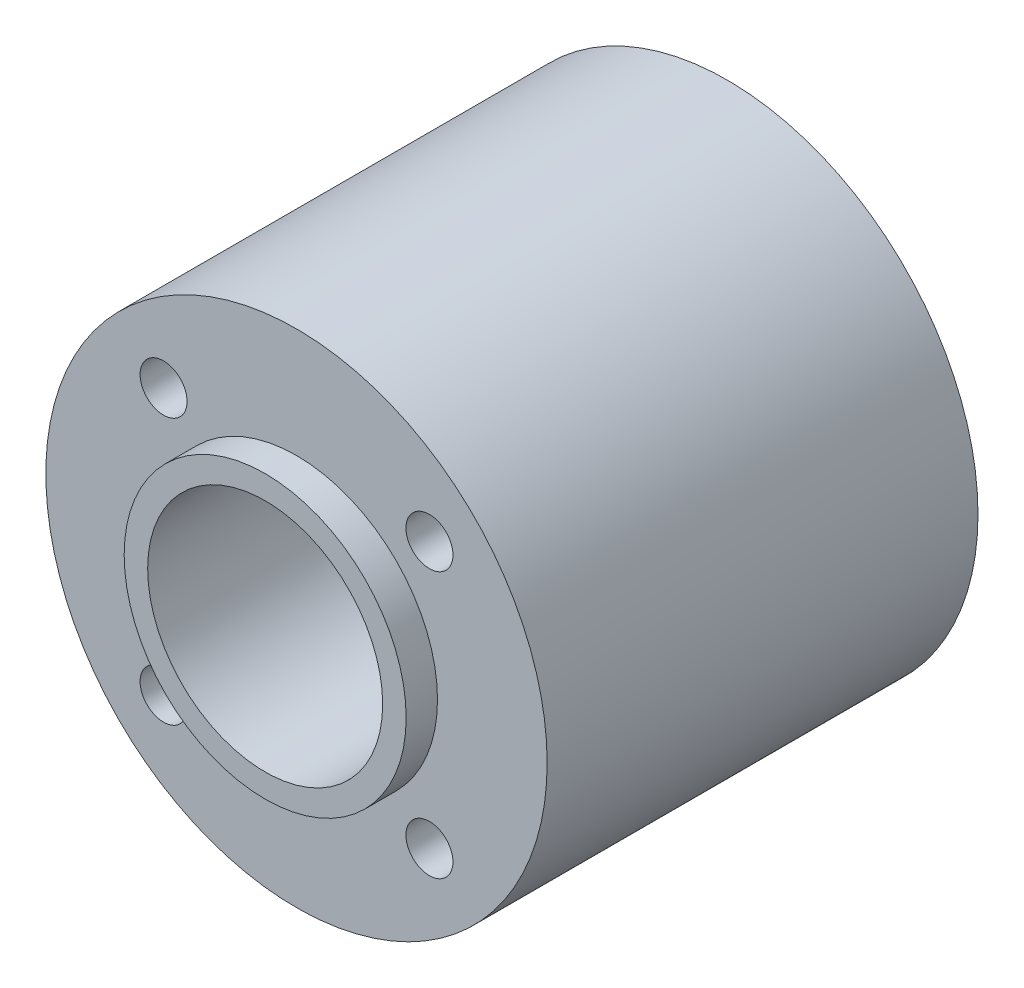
SolidWorks part; units mm, degrees
ref_plane "Plan de face" through (0, 0, 0) normal (0, 0, 1) x (1, 0, 0)
ref_plane "Plan de dessus" through (0, 0, 0) normal (0, 1, 0) x (1, 0, 0)
ref_plane "Plan de droite" through (0, 0, 0) normal (1, 0, 0) x (0, 0, -1)
sketch "Esquisse1" plane through (0, 0, 0) normal (0, 0, 1) x (1, 0, 0)
  circle A0 centre (0, 0) radius 16
  dimension "D1" = 32
extrude "Boss.-Extru.1" add sketch "Esquisse1" along normal mid plane 27.5
sketch "Esquisse2" plane through (0, 0, 13.75) normal (0, 0, 1) x (1, 0, 0)
  line L0 (0, -18.6653) -> (0, 22.848) construction
  line L1 (0, 0) -> (-8.4853, 8.4853) construction
  circle A0 centre (0, 0) radius 12 construction
  circle A1 centre (-8.4853, 8.4853) radius 1.5
  circle A2 centre (8.4853, 8.4853) radius 1.5
  circle A3 centre (8.4853, -8.4853) radius 1.5
  circle A4 centre (-8.4853, -8.4853) radius 1.5
  point P16 (0, 0)
  dimension "D1" = 24
  dimension "D2" = 3
  dimension "D3" = 45
  dimension "D4" = 4
extrude "Enlèv. mat.-Extru.1" cut sketch "Esquisse2" against normal through all
sketch "Esquisse3" plane through (0, 0, 13.75) normal (0, 0, 1) x (1, 0, 0)
  circle A0 centre (0, 0) radius 7.5
  dimension "D1" = 15
extrude "Enlèv. mat.-Extru.2" cut sketch "Esquisse3" against normal through all
sketch "Esquisse4" plane through (0, 0, 13.75) normal (0, 0, 1) x (1, 0, 0)
  circle A0 centre (0, 0) radius 9
  circle A1 centre (0, 0) radius 7.5 construction
  circle A2 centre (0, 0) radius 7.5
  dimension "D1" = 18
extrude "Boss.-Extru.2" add sketch "Esquisse4" along normal blind 2 contours A0 | A2
mirror "Symétrie1" about plane through (0, 0, 0) normal (0, 0, 1) of "Boss.-Extru.2"
